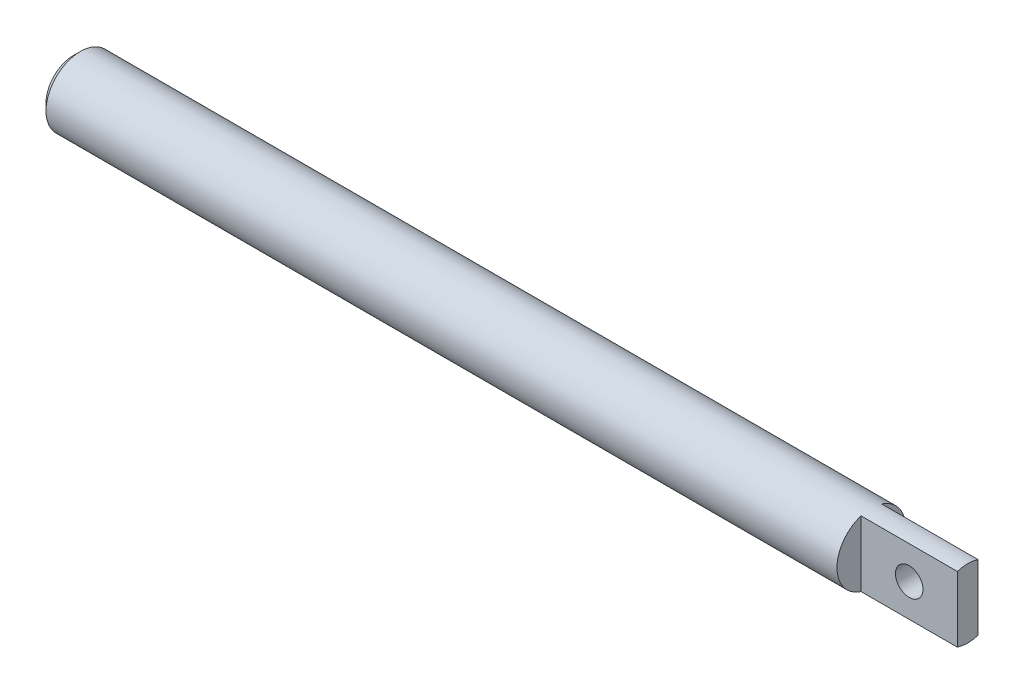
SolidWorks part; units mm, degrees
ref_plane "Front" through (0, 0, 0) normal (0, 0, 1) x (1, 0, 0)
ref_plane "Top" through (0, 0, 0) normal (0, 1, 0) x (1, 0, 0)
ref_plane "Right" through (0, 0, 0) normal (1, 0, 0) x (0, 0, -1)
sketch "Sketch1" plane through (0, 0, 0) normal (0, 1, 0) x (1, 0, 0)
  line L0 (0, 4) -> (1, 5)
  line L1 (0, 0) -> (130, 0)
  line L2 (0, 0) -> (0, 4)
  line L3 (1, 5) -> (130, 5)
  line L4 (130, 0) -> (130, 5)
  point P2 (0, 5)
revolve "Revolve1" add sketch "Sketch1" angle 360 about L1
sketch "Sketch3" plane through (130, 0, 0) normal (1, 0, 0) x (0, 0, -1)
  line L1 (-1.5, -5) -> (-8.5895, -5)
  line L2 (-1.5, 5) -> (-8.5895, 5)
  line L3 (-8.5895, 5) -> (-8.5895, -5)
  line L4 (-1.5, 5) -> (-1.5, -5)
  line L5 (1.5, 5) -> (1.5, -5)
  line L6 (1.5, 5) -> (8.5895, 5)
  line L7 (8.5895, 5) -> (8.5895, -5)
  line L8 (1.5, -5) -> (8.5895, -5)
extrude "Cut-Extrude2" cut sketch "Sketch3" against normal blind 14
sketch "Sketch4" plane through (0, 0, -1.5) normal (0, 0, -1) x (-1, 0, 0)
  circle A0 centre (-123, 0) radius 2
extrude "Cut-Extrude3" cut sketch "Sketch4" against normal through all
sketch "Sketch7" plane through (0, 0, 0) normal (0, 0, 1) x (1, 0, 0)
  line L0 (58, -14.8341) -> (62, -14.8341)
  line L1 (62, 0) -> (62, -14.8341) construction
  line L2 (62, -4) -> (62, -14.8341)
  line L3 (58, -4) -> (58, -14.8341)
  line L5 (58, -4) -> (62, -4)
  line L6 (58, 0) -> (58, -14.8341) construction
extrude "Cut-Extrude4" cut sketch "Sketch7" against normal mid plane 70
